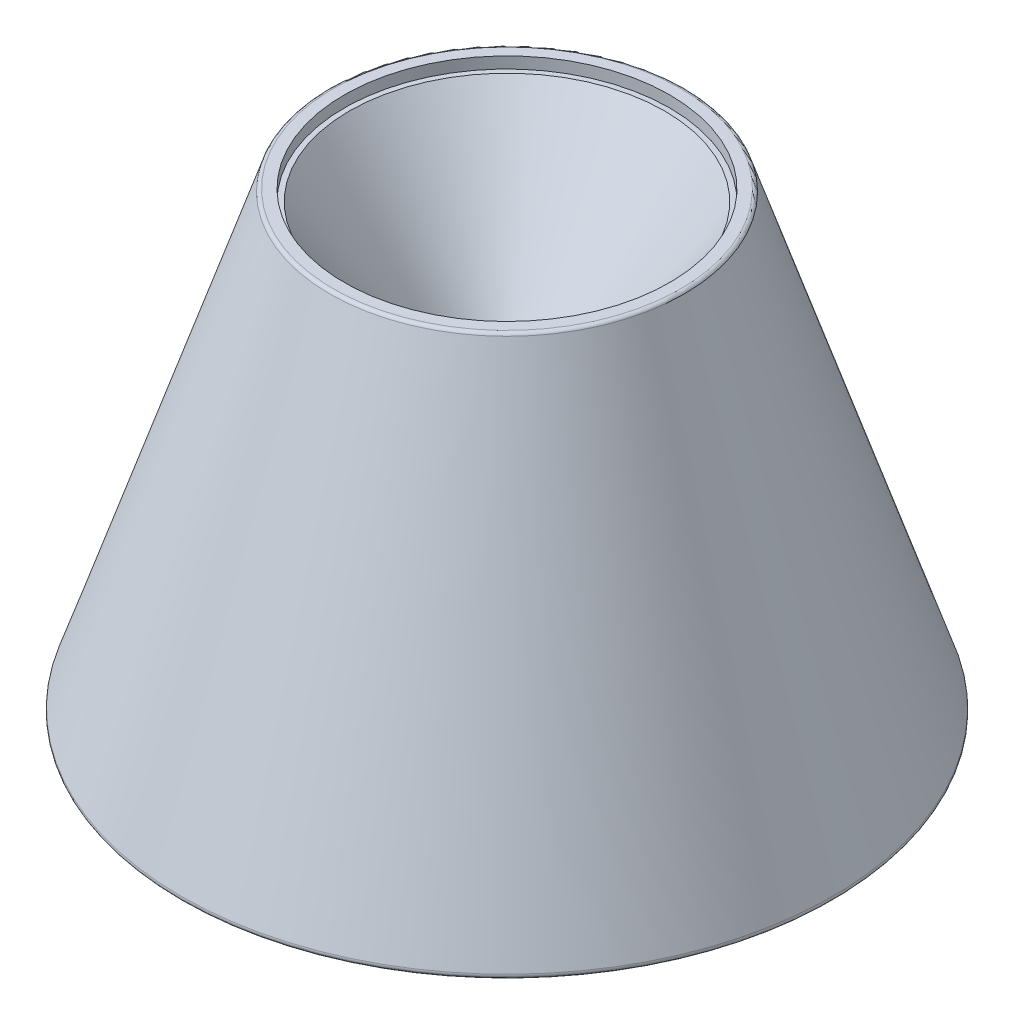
SolidWorks part; units mm, degrees
ref_plane "Alzado" through (0, 0, 0) normal (0, 0, 1) x (1, 0, 0)
ref_plane "Planta" through (0, 0, 0) normal (0, 1, 0) x (1, 0, 0)
ref_plane "Vista lateral" through (0, 0, 0) normal (1, 0, 0) x (0, 0, -1)
sketch "Croquis1" plane through (0, 0, 0) normal (0, 0, 1) x (1, 0, 0)
  line L0 (0, 0) -> (0, 120) construction
  line L1 (82.8586, 2.5) -> (83.6882, 0)
  line L2 (45.7782, 120) -> (42.9, 120)
  line L3 (46.7273, 119.315) -> (85.8859, 1.315)
  line L4 (42.9, 120) -> (42.9, 117)
  line L5 (42.9, 117) -> (41.55, 117)
  line L6 (0, 120) -> (0, 72.5) construction
  line L7 (0, 72.5) -> (10, 72.5) construction
  line L8 (41.55, 117) -> (10, 72.5)
  line L9 (10, 72.5) -> (0, 72.5)
  line L10 (0, 72.5) -> (5, 72.5)
  line L11 (5, 72.5) -> (5, 70)
  line L12 (84.9368, 0) -> (83.6882, 0)
  line L13 (45.405, 115.3622) -> (82.8586, 2.5)
  line L14 (45.4, 115.3773) -> (45.4, 115.3773)
  line L15 (11.2921, 70) -> (0, 70) construction
  line L16 (0, 72.5) -> (0, 70)
  line L17 (43.6401, 115.6256) -> (11.591, 70.4216)
  line L18 (10.7753, 70) -> (0, 70)
  line L20 (45.4, 115.3773) -> (82.8586, 2.5) construction
  line L21 (42.8421, 114.5) -> (11.2921, 70) construction
  line L22 (45.4, 114.5) -> (42.8421, 114.5) construction
  line L23 (45.4, 115.3773) -> (45.4, 114.5) construction
  line L24 (0, 2.5) -> (82.8586, 2.5) construction
  line L25 (0, 0) -> (84.9368, 0) construction
  arc A0 (46.7273, 119.315) -> (45.7782, 120) centre (45.7782, 119) ccw
  arc A1 (85.8859, 1.315) -> (84.9368, 0) centre (84.9368, 1) cw
  arc A2 (82.8586, 2.5) -> (82.8586, 2.5) centre (82.8586, 2.5) cw
  arc A3 (45.4, 115.3773) -> (45.4, 115.3773) centre (45.4, 115.3773) ccw
  arc A4 (45.405, 115.3622) -> (43.6401, 115.6256) centre (44.4559, 115.0472) ccw
  arc A5 (11.591, 70.4216) -> (10.7753, 70) centre (10.7753, 71) cw
  dimension "D2" = 47.5
  dimension "D3" = 1
  dimension "D4" = 1
  dimension "D14" = 1
  dimension "D15" = 1
  dimension "D1" = 120
  dimension "D5" = 45.7782
  dimension "D7" = 10
  dimension "D8" = 125.336
  dimension "D9" = 1.35
  dimension "D10" = 3
  dimension "D11" = 42.9
  dimension "D12" = 251.641
  dimension "D16" = 85.8859
  dimension "D13" = 2.5
revolve "Revolución1" add sketch "Croquis1" angle 360 about L0
sketch "Croquis2" plane through (0, 0, 0) normal (0, 1, 0) x (1, 0, 0)
  line L0 (0, 0) -> (-83.6847, 0) construction
  line L1 (-83.6575, -2.1319) -> (-45.3872, -1.271)
  line L2 (-83.6688, -1.632) -> (-45.3985, -0.7711)
  line L3 (-83.6688, 1.632) -> (-45.3985, 0.7711)
  line L4 (-83.6575, 2.1319) -> (-45.3872, 1.271)
  line L5 (-81.9443, 16.9783) -> (-44.4838, 9.1)
  line L6 (-81.8414, 17.4676) -> (-44.3809, 9.5892)
  line L7 (-82.6248, 13.2765) -> (-44.848, 7.0905)
  line L8 (-82.544, 13.7699) -> (-44.7672, 7.5839)
  line L9 (-77.4293, 31.7464) -> (-42.0542, 17.1189)
  line L10 (-77.2382, 32.2085) -> (-41.8632, 17.5809)
  line L11 (-78.7784, 28.2327) -> (-42.7815, 15.2106)
  line L12 (-78.6084, 28.7029) -> (-42.6114, 15.6808)
  line L13 (-70.2775, 45.4335) -> (-38.1926, 24.5548)
  line L14 (-70.0048, 45.8526) -> (-37.9199, 24.9739)
  line L15 (-72.2494, 42.2275) -> (-39.2581, 22.8127)
  line L16 (-71.9958, 42.6584) -> (-39.0045, 23.2436)
  line L17 (-60.7325, 57.5733) -> (-33.0304, 31.1546)
  line L18 (-60.3874, 57.9352) -> (-32.6853, 31.5165)
  line L19 (-63.2599, 54.7842) -> (-34.3978, 29.6379)
  line L20 (-62.9314, 55.1612) -> (-34.0694, 30.0149)
  line L21 (-49.1193, 67.7526) -> (-26.7433, 36.6935)
  line L22 (-48.7137, 68.0449) -> (-26.3376, 36.9857)
  line L23 (-52.1162, 65.4754) -> (-28.3662, 35.4538)
  line L24 (-51.7241, 65.7856) -> (-27.9741, 35.764)
  line L25 (-35.8335, 75.6247) -> (-19.5455, 40.9828)
  line L26 (-35.381, 75.8374) -> (-19.0931, 41.1955)
  line L27 (-39.1977, 73.9369) -> (-21.3686, 40.0624)
  line L28 (-38.7553, 74.1698) -> (-20.9261, 40.2953)
  line L29 (-21.3274, 80.9214) -> (-11.6822, 43.8764)
  line L30 (-20.8435, 81.0474) -> (-11.1983, 44.0024)
  line L31 (-24.9445, 79.8805) -> (-13.6433, 43.3068)
  line L32 (-24.4667, 80.0282) -> (-13.1656, 43.4544)
  line L33 (-6.0949, 83.4624) -> (-3.421, 45.276)
  line L34 (-5.5962, 83.4974) -> (-2.9222, 45.3109)
  line L35 (-9.8417, 83.104) -> (-5.4534, 45.0763)
  line L36 (-9.345, 83.1613) -> (-4.9567, 45.1336)
  line L37 (9.345, 83.1613) -> (4.9567, 45.1336)
  line L38 (9.8417, 83.104) -> (5.4534, 45.0763)
  line L39 (5.5962, 83.4974) -> (2.9222, 45.3109)
  line L40 (6.0949, 83.4624) -> (3.421, 45.276)
  line L41 (24.4667, 80.0282) -> (13.1656, 43.4544)
  line L42 (24.9445, 79.8805) -> (13.6433, 43.3068)
  line L43 (20.8435, 81.0474) -> (11.1983, 44.0024)
  line L44 (21.3274, 80.9214) -> (11.6822, 43.8764)
  line L45 (38.7553, 74.1698) -> (20.9261, 40.2953)
  line L46 (39.1977, 73.9369) -> (21.3686, 40.0624)
  line L47 (35.381, 75.8374) -> (19.0931, 41.1955)
  line L48 (35.8335, 75.6247) -> (19.5455, 40.9828)
  line L49 (51.7241, 65.7856) -> (27.9741, 35.764)
  line L50 (52.1162, 65.4754) -> (28.3662, 35.4538)
  line L51 (48.7137, 68.0449) -> (26.3376, 36.9857)
  line L52 (49.1193, 67.7526) -> (26.7433, 36.6935)
  line L53 (62.9314, 55.1612) -> (34.0694, 30.0149)
  line L54 (63.2599, 54.7842) -> (34.3978, 29.6379)
  line L55 (60.3874, 57.9352) -> (32.6853, 31.5165)
  line L56 (60.7325, 57.5733) -> (33.0304, 31.1546)
  line L57 (71.9958, 42.6584) -> (39.0045, 23.2436)
  line L58 (72.2494, 42.2275) -> (39.2581, 22.8127)
  line L59 (70.0048, 45.8526) -> (37.9199, 24.9739)
  line L60 (70.2775, 45.4335) -> (38.1926, 24.5548)
  line L61 (78.6084, 28.7029) -> (42.6114, 15.6808)
  line L62 (78.7784, 28.2327) -> (42.7815, 15.2106)
  line L63 (77.2382, 32.2085) -> (41.8632, 17.5809)
  line L64 (77.4293, 31.7464) -> (42.0542, 17.1189)
  line L65 (82.544, 13.7699) -> (44.7672, 7.5839)
  line L66 (82.6248, 13.2765) -> (44.848, 7.0905)
  line L67 (81.8414, 17.4676) -> (44.3809, 9.5892)
  line L68 (81.9443, 16.9783) -> (44.4838, 9.1)
  line L69 (83.6688, -1.632) -> (45.3985, -0.7711)
  line L70 (83.6575, -2.1319) -> (45.3872, -1.271)
  line L71 (83.6575, 2.1319) -> (45.3872, 1.271)
  line L72 (83.6688, 1.632) -> (45.3985, 0.7711)
  line L73 (81.9443, -16.9783) -> (44.4838, -9.1)
  line L74 (81.8414, -17.4676) -> (44.3809, -9.5892)
  line L75 (82.6248, -13.2765) -> (44.848, -7.0905)
  line L76 (82.544, -13.7699) -> (44.7672, -7.5839)
  line L77 (77.4293, -31.7464) -> (42.0542, -17.1189)
  line L78 (77.2382, -32.2085) -> (41.8632, -17.5809)
  line L79 (78.7784, -28.2327) -> (42.7815, -15.2106)
  line L80 (78.6084, -28.7029) -> (42.6114, -15.6808)
  line L81 (70.2775, -45.4335) -> (38.1926, -24.5548)
  line L82 (70.0048, -45.8526) -> (37.9199, -24.9739)
  line L83 (72.2494, -42.2275) -> (39.2581, -22.8127)
  line L84 (71.9958, -42.6584) -> (39.0045, -23.2436)
  line L85 (60.7325, -57.5733) -> (33.0304, -31.1546)
  line L86 (60.3874, -57.9352) -> (32.6853, -31.5165)
  line L87 (63.2599, -54.7842) -> (34.3978, -29.6379)
  line L88 (62.9314, -55.1612) -> (34.0694, -30.0149)
  line L89 (49.1193, -67.7526) -> (26.7433, -36.6935)
  line L90 (48.7137, -68.0449) -> (26.3376, -36.9857)
  line L91 (52.1162, -65.4754) -> (28.3662, -35.4538)
  line L92 (51.7241, -65.7856) -> (27.9741, -35.764)
  line L93 (35.8335, -75.6247) -> (19.5455, -40.9828)
  line L94 (35.381, -75.8374) -> (19.0931, -41.1955)
  line L95 (39.1977, -73.9369) -> (21.3686, -40.0624)
  line L96 (38.7553, -74.1698) -> (20.9261, -40.2953)
  line L97 (21.3274, -80.9214) -> (11.6822, -43.8764)
  line L98 (20.8435, -81.0474) -> (11.1983, -44.0024)
  line L99 (24.9445, -79.8805) -> (13.6433, -43.3068)
  line L100 (24.4667, -80.0282) -> (13.1656, -43.4544)
  line L101 (6.0949, -83.4624) -> (3.421, -45.276)
  line L102 (5.5962, -83.4974) -> (2.9222, -45.3109)
  line L103 (9.8417, -83.104) -> (5.4534, -45.0763)
  line L104 (9.345, -83.1613) -> (4.9567, -45.1336)
  line L105 (-9.345, -83.1613) -> (-4.9567, -45.1336)
  line L106 (-9.8417, -83.104) -> (-5.4534, -45.0763)
  line L107 (-5.5962, -83.4974) -> (-2.9222, -45.3109)
  line L108 (-6.0949, -83.4624) -> (-3.421, -45.276)
  line L109 (-24.4667, -80.0282) -> (-13.1656, -43.4544)
  line L110 (-24.9445, -79.8805) -> (-13.6433, -43.3068)
  line L111 (-20.8435, -81.0474) -> (-11.1983, -44.0024)
  line L112 (-21.3274, -80.9214) -> (-11.6822, -43.8764)
  line L113 (-38.7553, -74.1698) -> (-20.9261, -40.2953)
  line L114 (-39.1977, -73.9369) -> (-21.3686, -40.0624)
  line L115 (-35.381, -75.8374) -> (-19.0931, -41.1955)
  line L116 (-35.8335, -75.6247) -> (-19.5455, -40.9828)
  line L117 (-51.7241, -65.7856) -> (-27.9741, -35.764)
  line L118 (-52.1162, -65.4754) -> (-28.3662, -35.4538)
  line L119 (-48.7137, -68.0449) -> (-26.3376, -36.9857)
  line L120 (-49.1193, -67.7526) -> (-26.7433, -36.6935)
  line L121 (-62.9314, -55.1612) -> (-34.0694, -30.0149)
  line L122 (-63.2599, -54.7842) -> (-34.3978, -29.6379)
  line L123 (-60.3874, -57.9352) -> (-32.6853, -31.5165)
  line L124 (-60.7325, -57.5733) -> (-33.0304, -31.1546)
  line L125 (-71.9958, -42.6584) -> (-39.0045, -23.2436)
  line L126 (-72.2494, -42.2275) -> (-39.2581, -22.8127)
  line L127 (-70.0048, -45.8526) -> (-37.9199, -24.9739)
  line L128 (-70.2775, -45.4335) -> (-38.1926, -24.5548)
  line L129 (-78.6084, -28.7029) -> (-42.6114, -15.6808)
  line L130 (-78.7784, -28.2327) -> (-42.7815, -15.2106)
  line L131 (-77.2382, -32.2085) -> (-41.8632, -17.5809)
  line L132 (-77.4293, -31.7464) -> (-42.0542, -17.1189)
  line L133 (-82.544, -13.7699) -> (-44.7672, -7.5839)
  line L134 (-82.6248, -13.2765) -> (-44.848, -7.0905)
  line L135 (-81.8414, -17.4676) -> (-44.3809, -9.5892)
  line L136 (-81.9443, -16.9783) -> (-44.4838, -9.1)
  arc A0 (-45.3872, 1.271) -> (-45.3985, 0.7711) centre (0, 0) ccw
  arc A1 (-83.6575, 2.1319) -> (-83.6688, 1.632) centre (0, 0) ccw
  arc A2 (-45.3985, -0.7711) -> (-45.3872, -1.271) centre (0, 0) ccw
  arc A3 (-83.6688, -1.632) -> (-83.6575, -2.1319) centre (0, 0) ccw
  arc A4 (-44.7672, 7.5839) -> (-44.848, 7.0905) centre (0, 0) ccw
  arc A5 (-82.544, 13.7699) -> (-82.6248, 13.2765) centre (0, 0) ccw
  arc A6 (-44.3809, 9.5892) -> (-44.4838, 9.1) centre (0, 0) ccw
  arc A7 (-81.8414, 17.4676) -> (-81.9443, 16.9783) centre (0, 0) ccw
  arc A8 (-42.6114, 15.6808) -> (-42.7815, 15.2106) centre (0, 0) ccw
  arc A9 (-78.6084, 28.7029) -> (-78.7784, 28.2327) centre (0, 0) ccw
  arc A10 (-41.8632, 17.5809) -> (-42.0542, 17.1189) centre (0, 0) ccw
  arc A11 (-77.2382, 32.2085) -> (-77.4293, 31.7464) centre (0, 0) ccw
  arc A12 (-39.0045, 23.2436) -> (-39.2581, 22.8127) centre (0, 0) ccw
  arc A13 (-71.9958, 42.6584) -> (-72.2494, 42.2275) centre (0, 0) ccw
  arc A14 (-37.9199, 24.9739) -> (-38.1926, 24.5548) centre (0, 0) ccw
  arc A15 (-70.0048, 45.8526) -> (-70.2775, 45.4335) centre (0, 0) ccw
  arc A16 (-34.0694, 30.0149) -> (-34.3978, 29.6379) centre (0, 0) ccw
  arc A17 (-62.9314, 55.1612) -> (-63.2599, 54.7842) centre (0, 0) ccw
  arc A18 (-32.6853, 31.5165) -> (-33.0304, 31.1546) centre (0, 0) ccw
  arc A19 (-60.3874, 57.9352) -> (-60.7325, 57.5733) centre (0, 0) ccw
  arc A20 (-27.9741, 35.764) -> (-28.3662, 35.4538) centre (0, 0) ccw
  arc A21 (-51.7241, 65.7856) -> (-52.1162, 65.4754) centre (0, 0) ccw
  arc A22 (-26.3376, 36.9857) -> (-26.7433, 36.6935) centre (0, 0) ccw
  arc A23 (-48.7137, 68.0449) -> (-49.1193, 67.7526) centre (0, 0) ccw
  arc A24 (-20.9261, 40.2953) -> (-21.3686, 40.0624) centre (0, 0) ccw
  arc A25 (-38.7553, 74.1698) -> (-39.1977, 73.9369) centre (0, 0) ccw
  arc A26 (-19.0931, 41.1955) -> (-19.5455, 40.9828) centre (0, 0) ccw
  arc A27 (-35.381, 75.8374) -> (-35.8335, 75.6247) centre (0, 0) ccw
  arc A28 (-13.1656, 43.4544) -> (-13.6433, 43.3068) centre (0, 0) ccw
  arc A29 (-24.4667, 80.0282) -> (-24.9445, 79.8805) centre (0, 0) ccw
  arc A30 (-11.1983, 44.0024) -> (-11.6822, 43.8764) centre (0, 0) ccw
  arc A31 (-20.8435, 81.0474) -> (-21.3274, 80.9214) centre (0, 0) ccw
  arc A32 (-4.9567, 45.1336) -> (-5.4534, 45.0763) centre (0, 0) ccw
  arc A33 (-9.345, 83.1613) -> (-9.8417, 83.104) centre (0, 0) ccw
  arc A34 (-2.9222, 45.3109) -> (-3.421, 45.276) centre (0, 0) ccw
  arc A35 (-5.5962, 83.4974) -> (-6.0949, 83.4624) centre (0, 0) ccw
  arc A36 (3.421, 45.276) -> (2.9222, 45.3109) centre (0, 0) ccw
  arc A37 (6.0949, 83.4624) -> (5.5962, 83.4974) centre (0, 0) ccw
  arc A38 (5.4534, 45.0763) -> (4.9567, 45.1336) centre (0, 0) ccw
  arc A39 (9.8417, 83.104) -> (9.345, 83.1613) centre (0, 0) ccw
  arc A40 (11.6822, 43.8764) -> (11.1983, 44.0024) centre (0, 0) ccw
  arc A41 (21.3274, 80.9214) -> (20.8435, 81.0474) centre (0, 0) ccw
  arc A42 (13.6433, 43.3068) -> (13.1656, 43.4544) centre (0, 0) ccw
  arc A43 (24.9445, 79.8805) -> (24.4667, 80.0282) centre (0, 0) ccw
  arc A44 (19.5455, 40.9828) -> (19.0931, 41.1955) centre (0, 0) ccw
  arc A45 (35.8335, 75.6247) -> (35.381, 75.8374) centre (0, 0) ccw
  arc A46 (21.3686, 40.0624) -> (20.9261, 40.2953) centre (0, 0) ccw
  arc A47 (39.1977, 73.9369) -> (38.7553, 74.1698) centre (0, 0) ccw
  arc A48 (26.7433, 36.6935) -> (26.3376, 36.9857) centre (0, 0) ccw
  arc A49 (49.1193, 67.7526) -> (48.7137, 68.0449) centre (0, 0) ccw
  arc A50 (28.3662, 35.4538) -> (27.9741, 35.764) centre (0, 0) ccw
  arc A51 (52.1162, 65.4754) -> (51.7241, 65.7856) centre (0, 0) ccw
  arc A52 (33.0304, 31.1546) -> (32.6853, 31.5165) centre (0, 0) ccw
  arc A53 (60.7325, 57.5733) -> (60.3874, 57.9352) centre (0, 0) ccw
  arc A54 (34.3978, 29.6379) -> (34.0694, 30.0149) centre (0, 0) ccw
  arc A55 (63.2599, 54.7842) -> (62.9314, 55.1612) centre (0, 0) ccw
  arc A56 (38.1926, 24.5548) -> (37.9199, 24.9739) centre (0, 0) ccw
  arc A57 (70.2775, 45.4335) -> (70.0048, 45.8526) centre (0, 0) ccw
  arc A58 (39.2581, 22.8127) -> (39.0045, 23.2436) centre (0, 0) ccw
  arc A59 (72.2494, 42.2275) -> (71.9958, 42.6584) centre (0, 0) ccw
  arc A60 (42.0542, 17.1189) -> (41.8632, 17.5809) centre (0, 0) ccw
  arc A61 (77.4293, 31.7464) -> (77.2382, 32.2085) centre (0, 0) ccw
  arc A62 (42.7815, 15.2106) -> (42.6114, 15.6808) centre (0, 0) ccw
  arc A63 (78.7784, 28.2327) -> (78.6084, 28.7029) centre (0, 0) ccw
  arc A64 (44.4838, 9.1) -> (44.3809, 9.5892) centre (0, 0) ccw
  arc A65 (81.9443, 16.9783) -> (81.8414, 17.4676) centre (0, 0) ccw
  arc A66 (44.848, 7.0905) -> (44.7672, 7.5839) centre (0, 0) ccw
  arc A67 (82.6248, 13.2765) -> (82.544, 13.7699) centre (0, 0) ccw
  arc A68 (45.3985, 0.7711) -> (45.3872, 1.271) centre (0, 0) ccw
  arc A69 (83.6688, 1.632) -> (83.6575, 2.1319) centre (0, 0) ccw
  arc A70 (45.3872, -1.271) -> (45.3985, -0.7711) centre (0, 0) ccw
  arc A71 (83.6575, -2.1319) -> (83.6688, -1.632) centre (0, 0) ccw
  arc A72 (44.7672, -7.5839) -> (44.848, -7.0905) centre (0, 0) ccw
  arc A73 (82.544, -13.7699) -> (82.6248, -13.2765) centre (0, 0) ccw
  arc A74 (44.3809, -9.5892) -> (44.4838, -9.1) centre (0, 0) ccw
  arc A75 (81.8414, -17.4676) -> (81.9443, -16.9783) centre (0, 0) ccw
  arc A76 (42.6114, -15.6808) -> (42.7815, -15.2106) centre (0, 0) ccw
  arc A77 (78.6084, -28.7029) -> (78.7784, -28.2327) centre (0, 0) ccw
  arc A78 (41.8632, -17.5809) -> (42.0542, -17.1189) centre (0, 0) ccw
  arc A79 (77.2382, -32.2085) -> (77.4293, -31.7464) centre (0, 0) ccw
  arc A80 (39.0045, -23.2436) -> (39.2581, -22.8127) centre (0, 0) ccw
  arc A81 (71.9958, -42.6584) -> (72.2494, -42.2275) centre (0, 0) ccw
  arc A82 (37.9199, -24.9739) -> (38.1926, -24.5548) centre (0, 0) ccw
  arc A83 (70.0048, -45.8526) -> (70.2775, -45.4335) centre (0, 0) ccw
  arc A84 (34.0694, -30.0149) -> (34.3978, -29.6379) centre (0, 0) ccw
  arc A85 (62.9314, -55.1612) -> (63.2599, -54.7842) centre (0, 0) ccw
  arc A86 (32.6853, -31.5165) -> (33.0304, -31.1546) centre (0, 0) ccw
  arc A87 (60.3874, -57.9352) -> (60.7325, -57.5733) centre (0, 0) ccw
  arc A88 (27.9741, -35.764) -> (28.3662, -35.4538) centre (0, 0) ccw
  arc A89 (51.7241, -65.7856) -> (52.1162, -65.4754) centre (0, 0) ccw
  arc A90 (26.3376, -36.9857) -> (26.7433, -36.6935) centre (0, 0) ccw
  arc A91 (48.7137, -68.0449) -> (49.1193, -67.7526) centre (0, 0) ccw
  arc A92 (20.9261, -40.2953) -> (21.3686, -40.0624) centre (0, 0) ccw
  arc A93 (38.7553, -74.1698) -> (39.1977, -73.9369) centre (0, 0) ccw
  arc A94 (19.0931, -41.1955) -> (19.5455, -40.9828) centre (0, 0) ccw
  arc A95 (35.381, -75.8374) -> (35.8335, -75.6247) centre (0, 0) ccw
  arc A96 (13.1656, -43.4544) -> (13.6433, -43.3068) centre (0, 0) ccw
  arc A97 (24.4667, -80.0282) -> (24.9445, -79.8805) centre (0, 0) ccw
  arc A98 (11.1983, -44.0024) -> (11.6822, -43.8764) centre (0, 0) ccw
  arc A99 (20.8435, -81.0474) -> (21.3274, -80.9214) centre (0, 0) ccw
  arc A100 (4.9567, -45.1336) -> (5.4534, -45.0763) centre (0, 0) ccw
  arc A101 (9.345, -83.1613) -> (9.8417, -83.104) centre (0, 0) ccw
  arc A102 (2.9222, -45.3109) -> (3.421, -45.276) centre (0, 0) ccw
  arc A103 (5.5962, -83.4974) -> (6.0949, -83.4624) centre (0, 0) ccw
  arc A104 (-3.421, -45.276) -> (-2.9222, -45.3109) centre (0, 0) ccw
  arc A105 (-6.0949, -83.4624) -> (-5.5962, -83.4974) centre (0, 0) ccw
  arc A106 (-5.4534, -45.0763) -> (-4.9567, -45.1336) centre (0, 0) ccw
  arc A107 (-9.8417, -83.104) -> (-9.345, -83.1613) centre (0, 0) ccw
  arc A108 (-11.6822, -43.8764) -> (-11.1983, -44.0024) centre (0, 0) ccw
  arc A109 (-21.3274, -80.9214) -> (-20.8435, -81.0474) centre (0, 0) ccw
  arc A110 (-13.6433, -43.3068) -> (-13.1656, -43.4544) centre (0, 0) ccw
  arc A111 (-24.9445, -79.8805) -> (-24.4667, -80.0282) centre (0, 0) ccw
  arc A112 (-19.5455, -40.9828) -> (-19.0931, -41.1955) centre (0, 0) ccw
  arc A113 (-35.8335, -75.6247) -> (-35.381, -75.8374) centre (0, 0) ccw
  arc A114 (-21.3686, -40.0624) -> (-20.9261, -40.2953) centre (0, 0) ccw
  arc A115 (-39.1977, -73.9369) -> (-38.7553, -74.1698) centre (0, 0) ccw
  arc A116 (-26.7433, -36.6935) -> (-26.3376, -36.9857) centre (0, 0) ccw
  arc A117 (-49.1193, -67.7526) -> (-48.7137, -68.0449) centre (0, 0) ccw
  arc A118 (-28.3662, -35.4538) -> (-27.9741, -35.764) centre (0, 0) ccw
  arc A119 (-52.1162, -65.4754) -> (-51.7241, -65.7856) centre (0, 0) ccw
  arc A120 (-33.0304, -31.1546) -> (-32.6853, -31.5165) centre (0, 0) ccw
  arc A121 (-60.7325, -57.5733) -> (-60.3874, -57.9352) centre (0, 0) ccw
  arc A122 (-34.3978, -29.6379) -> (-34.0694, -30.0149) centre (0, 0) ccw
  arc A123 (-63.2599, -54.7842) -> (-62.9314, -55.1612) centre (0, 0) ccw
  arc A124 (-38.1926, -24.5548) -> (-37.9199, -24.9739) centre (0, 0) ccw
  arc A125 (-70.2775, -45.4335) -> (-70.0048, -45.8526) centre (0, 0) ccw
  arc A126 (-39.2581, -22.8127) -> (-39.0045, -23.2436) centre (0, 0) ccw
  arc A127 (-72.2494, -42.2275) -> (-71.9958, -42.6584) centre (0, 0) ccw
  arc A128 (-42.0542, -17.1189) -> (-41.8632, -17.5809) centre (0, 0) ccw
  arc A129 (-77.4293, -31.7464) -> (-77.2382, -32.2085) centre (0, 0) ccw
  arc A130 (-42.7815, -15.2106) -> (-42.6114, -15.6808) centre (0, 0) ccw
  arc A131 (-78.7784, -28.2327) -> (-78.6084, -28.7029) centre (0, 0) ccw
  arc A132 (-44.4838, -9.1) -> (-44.3809, -9.5892) centre (0, 0) ccw
  arc A133 (-81.9443, -16.9783) -> (-81.8414, -17.4676) centre (0, 0) ccw
  arc A134 (-44.848, -7.0905) -> (-44.7672, -7.5839) centre (0, 0) ccw
  arc A135 (-82.6248, -13.2765) -> (-82.544, -13.7699) centre (0, 0) ccw
  point P278 (0, 0)
  dimension "D1" = 0.5
  dimension "D2" = 34
extrude "Saliente-Extruir1" add sketch "Croquis2" along normal up to next
